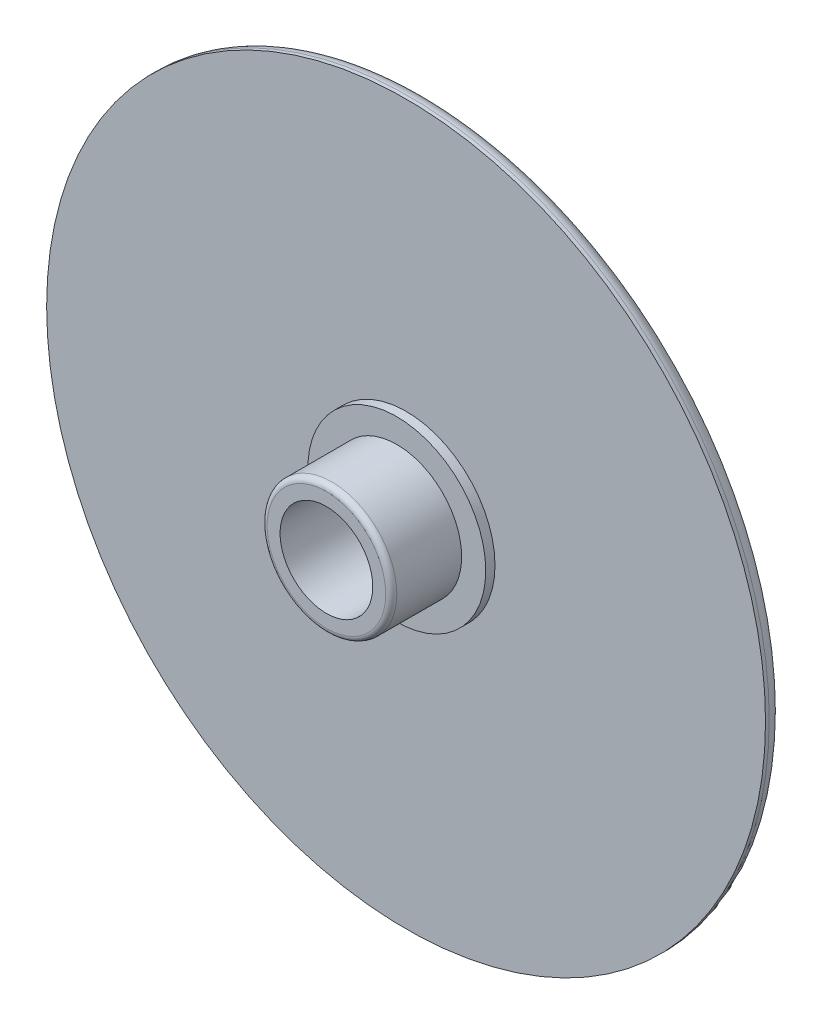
SolidWorks part; units mm, degrees
ref_plane "Face" through (0, 0, 0) normal (0, 0, 1) x (1, 0, 0)
ref_plane "Dessus" through (0, 0, 0) normal (0, 1, 0) x (1, 0, 0)
ref_plane "Droite" through (0, 0, 0) normal (1, 0, 0) x (0, 0, -1)
sketch "Esquisse1" plane through (0, 0, 0) normal (0, 0, 1) x (1, 0, 0)
  circle A0 centre (0, 0) radius 19.4
  dimension "D1" = 38.8
extrude "Base-Extrusion" add sketch "Esquisse1" along normal blind 1
fillet "Congé1" radius 0.8
sketch "Esquisse2" plane through (0, 0, 1) normal (0, 0, 1) x (1, 0, 0)
  circle A0 centre (0, 0) radius 4.8
  dimension "D1" = 9.6
extrude "Boss.-Extru.1" add sketch "Esquisse2" along normal blind 0.5
sketch "Esquisse3" plane through (0, 0, 1.5) normal (0, 0, 1) x (1, 0, 0)
  circle A0 centre (0, 0) radius 3.5
  dimension "D1" = 7
extrude "Boss.-Extru.2" add sketch "Esquisse3" along normal blind 3.8
fillet "Congé2" radius 0.3
sketch "Esquisse4" plane through (0, 0, 5.3) normal (0, 0, 1) x (1, 0, 0)
  circle A0 centre (0, 0) radius 2.5
  dimension "D1" = 5
extrude "Enlèv. mat.-Extru.1" cut sketch "Esquisse4" against normal through all
